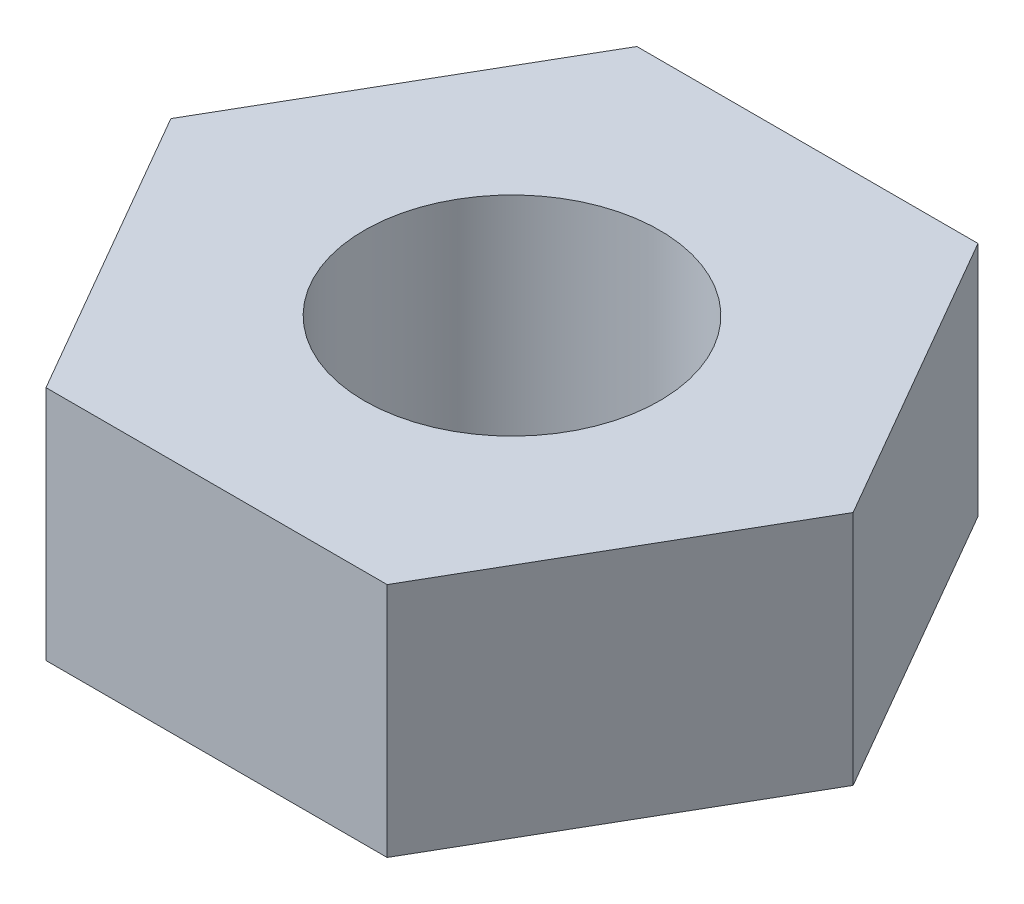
SolidWorks part; units mm, degrees
ref_plane "Front" through (0, 0, 0) normal (0, 0, 1) x (1, 0, 0)
ref_plane "Top" through (0, 0, 0) normal (0, 1, 0) x (1, 0, 0)
ref_plane "Right" through (0, 0, 0) normal (1, 0, 0) x (0, 0, -1)
sketch "Sketch1" plane through (0, 0, 0) normal (0, 1, 0) x (1, 0, 0)
  line L1 (2.3094, 0) -> (1.1547, 2)
  line L2 (1.1547, 2) -> (-1.1547, 2)
  line L3 (-1.1547, 2) -> (-2.3094, 0)
  line L4 (-2.3094, 0) -> (-1.1547, -2)
  line L5 (-1.1547, -2) -> (1.1547, -2)
  line L6 (1.1547, -2) -> (2.3094, 0)
  circle A0 centre (0, 0) radius 2 construction
  dimension "FLATS" = 4
extrude "Base-Extrude" add sketch "Sketch1" along normal blind 1.6
sketch "Sketch2" plane through (0, 1.6, 0) normal (0, 1, 0) x (-1, 0, 0)
  circle A0 centre (0, 0) radius 1
  dimension "SIZE" = 2
extrude "Cut-Extrude1" cut sketch "Sketch2" against normal through all
